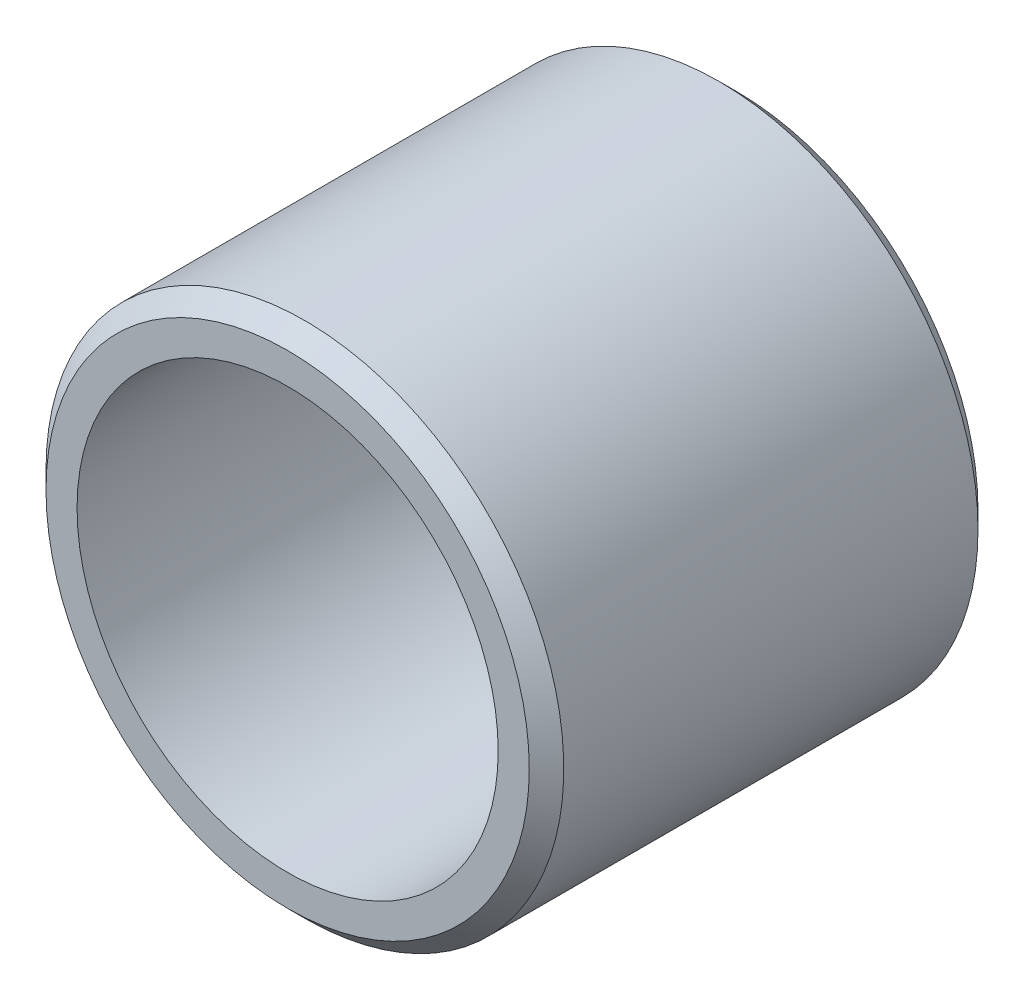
SolidWorks part; units mm, degrees
ref_plane "Front Plane" through (0, 0, 0) normal (0, 0, 1) x (1, 0, 0)
ref_plane "Top Plane" through (0, 0, 0) normal (0, 1, 0) x (1, 0, 0)
ref_plane "Right Plane" through (0, 0, 0) normal (1, 0, 0) x (0, 0, -1)
sketch "Sketch2" plane through (0, 0, 0) normal (0, 0, 1) x (1, 0, 0)
  circle A0 centre (0, 0) radius 7.5
  circle A1 centre (0, 0) radius 6.1
  dimension "D1" = 15
  dimension "D2" = 12.2
extrude "Boss-Extrude1" add sketch "Sketch2" along normal blind 13
chamfer "Chamfer1" distance 0.5 angle 45 2 edges at (7.5, 0, 0) (7.5, 0, 13)
